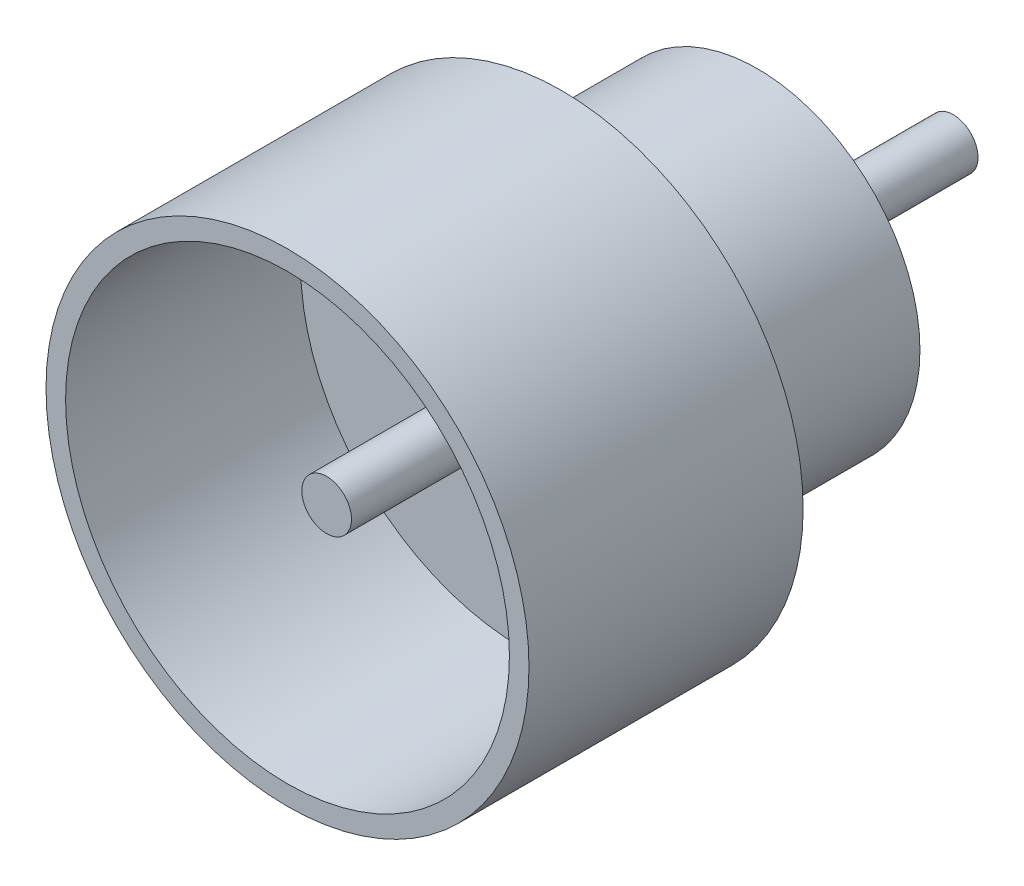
SolidWorks part; units mm, degrees
ref_plane "前视" through (0, 0, 0) normal (0, 0, 1) x (1, 0, 0)
ref_plane "上视" through (0, 0, 0) normal (0, 1, 0) x (1, 0, 0)
ref_plane "右视" through (0, 0, 0) normal (1, 0, 0) x (0, 0, -1)
sketch "草图1" plane through (0, 0, 0) normal (0, 0, 1) x (1, 0, 0)
  circle A0 centre (0, 0) radius 1.85
  dimension "D1" = 3.7
extrude "凸台-拉伸1" add sketch "草图1" along normal blind 2.1
sketch "草图2" plane through (0, 0, 2.1) normal (0, 0, 1) x (1, 0, 0)
  circle A0 centre (0, 0) radius 1.7
  dimension "D1" = 3.4
extrude "切除-拉伸1" cut sketch "草图2" against normal blind 1.8
sketch "草图3" plane through (0, 0, 0.3) normal (0, 0, 1) x (1, 0, 0)
  circle A0 centre (0, 0) radius 0.19
  dimension "D1" = 0.38
extrude "凸台-拉伸2" add sketch "草图3" along normal blind 1.5
sketch "草图4" plane through (0, 0, 0) normal (0, 0, -1) x (-1, 0, 0)
  circle A0 centre (0, 0) radius 1.245
  dimension "D1" = 2.49
extrude "凸台-拉伸3" add sketch "草图4" along normal blind 1.5
sketch "草图5" plane through (0, 0, -1.5) normal (0, 0, -1) x (-1, 0, 0)
  circle A0 centre (0, 0) radius 0.19
  dimension "D1" = 0.38
extrude "凸台-拉伸4" add sketch "草图5" along normal blind 1.5
